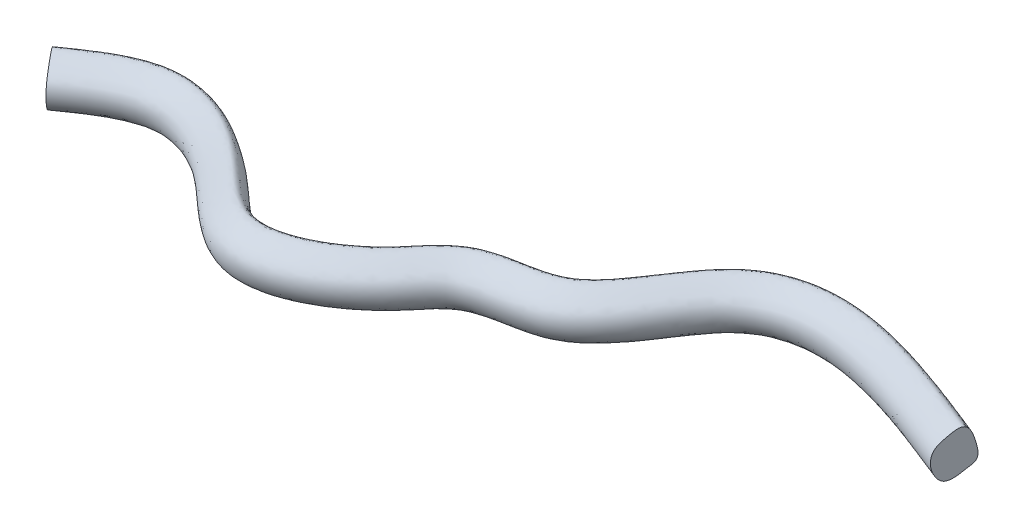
SolidWorks part; units mm, degrees
ref_plane "Y" through (0, 0, 0) normal (0, 0, 1) x (1, 0, 0)
ref_plane "Z" through (0, 0, 0) normal (0, 1, 0) x (1, 0, 0)
ref_plane "X" through (0, 0, 0) normal (1, 0, 0) x (0, 0, -1)
sketch "Skizze1" plane through (0, 0, 0) normal (0, 1, 0) x (1, 0, 0)
  spline S0 degree 3 poles (-71.9928, -32.8385) (-54.3466, -20.3934) (-18.0149, 5.2297) (47.2163, -24.9255) (98.2606, -89.2982) (170.4647, -49.2665) (204.2309, 0.6669) (274.9715, -3.1522) (319.151, 126.0397) (421.4421, 85.1368) (488.2558, 58.4202) knots 0 0 0 0 0.095271 0.196152 0.304088 0.444044 0.496074 0.582323 0.727185 1 1 1 1
ref_plane "Ebene1" through (-71.9928, 0, 32.8385) normal (0.8172, 0, -0.5763) x (-0.5763, 0, -0.8172)
sketch "Skizze3" plane through (-71.9928, 0, 32.8385) normal (0.8172, 0, -0.5763) x (-0.5763, 0, -0.8172)
  spline S0 degree 3 poles (10.725, 25.9312) (0.6895, 19.389) (-9.1085, 12.9421) (-11.2787, 0.761) (-3.134, -13.2499) (13.6231, -1.5461) (18.8454, -0.2785) (10.725, 25.9312) (0.6895, 19.389) (-9.1085, 12.9421) knots -0.411691 -0.177569 -0.177569 0 0.138177 0.264871 0.420878 0.588309 0.822431 0.822431 1 1.138177 1.264871 1.420878 only from (0.4, 19.1868) to (0.4, 19.1868)
sweep "Austragung4" add profiles "Skizze3" path "Skizze1"
